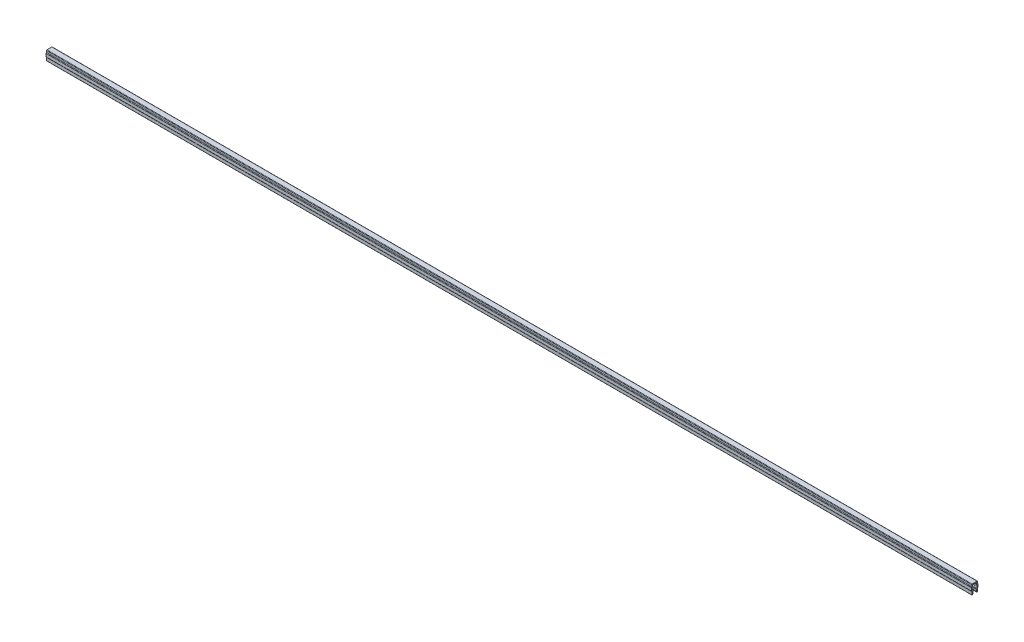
SolidWorks part; units mm, degrees
ref_plane "正面" through (0, 0, 0) normal (0, 0, 1) x (1, 0, 0)
ref_plane "平面" through (0, 0, 0) normal (0, 1, 0) x (1, 0, 0)
ref_plane "右側面" through (0, 0, 0) normal (1, 0, 0) x (0, 0, -1)
sketch "ｽｹｯﾁ1" plane through (0, 0, 0) normal (1, 0, 0) x (0, 0, -1)
  line L48 (-2.0164, -9.4834) -> (-2.5164, -10.3494)
  line L49 (-2.5164, -10.3494) -> (-2.7164, -10.3494)
  line L50 (-3.0164, -10.0494) -> (-3.0164, -7.0359)
  line L51 (-2.0164, -9.4834) -> (-2.0164, -7.4155)
  line L52 (-0.8966, -6.2427) -> (-1.8378, -7.0325)
  line L53 (-1.8164, -5.8895) -> (-1.0252, -5.8895)
  line L54 (-3.6164, -5.9966) -> (-3.6164, -3.0741)
  line L55 (-2.6164, -5.0895) -> (-2.6164, -3.6396)
  line L56 (-2.1164, -2.7736) -> (-2.1164, -1.5)
  line L57 (-3.1164, -2.0494) -> (-3.1164, -0.5)
  line L58 (3.1164, -2.2081) -> (3.1164, -0.5)
  line L59 (2.6164, -5.0895) -> (2.6164, -3.6396)
  line L60 (3.6164, -5.9966) -> (3.6164, -3.0741)
  line L61 (3.0164, -10.0494) -> (3.0164, -7.0359)
  line L62 (2.1164, -2.7736) -> (2.1164, -1.5)
  line L63 (1.8164, -5.8895) -> (1.0252, -5.8895)
  line L64 (0.8966, -6.2427) -> (1.8378, -7.0325)
  line L65 (1.6164, -1) -> (-1.6164, -1)
  line L66 (2.6164, 0) -> (-2.6164, 0)
  line L67 (2.0164, -9.4834) -> (2.5164, -10.3494)
  line L68 (2.0164, -9.4834) -> (2.0164, -7.4155)
  line L69 (2.5164, -10.3494) -> (2.7164, -10.3494)
  arc A50 (-3.0164, -10.0494) -> (-2.7164, -10.3494) centre (-2.7164, -10.0494) ccw
  arc A51 (-3.6164, -5.9966) -> (-3.3664, -6.4297) centre (-3.1164, -5.9966) ccw
  arc A52 (-3.0164, -7.0359) -> (-3.3664, -6.4297) centre (-3.7164, -7.0359) ccw
  arc A53 (-2.6164, -5.0895) -> (-1.8164, -5.8895) centre (-1.8164, -5.0895) ccw
  arc A54 (-3.4241, -2.68) -> (-3.6164, -3.0741) centre (-3.1164, -3.0741) ccw
  arc A55 (-3.4241, -2.68) -> (-3.1164, -2.0494) centre (-3.9164, -2.0494) ccw
  arc A56 (-2.3664, -3.2066) -> (-2.1164, -2.7736) centre (-2.6164, -2.7736) ccw
  arc A57 (-2.3664, -3.2066) -> (-2.6164, -3.6396) centre (-2.1164, -3.6396) ccw
  arc A58 (1.8164, -5.8895) -> (2.6164, -5.0895) centre (1.8164, -5.0895) ccw
  arc A59 (3.3664, -6.4297) -> (3.6164, -5.9966) centre (3.1164, -5.9966) ccw
  arc A60 (3.6164, -3.0741) -> (3.3664, -2.6411) centre (3.1164, -3.0741) ccw
  arc A61 (2.6164, -3.6396) -> (2.3664, -3.2066) centre (2.1164, -3.6396) ccw
  arc A62 (3.3664, -6.4297) -> (3.0164, -7.0359) centre (3.7164, -7.0359) ccw
  arc A63 (2.7164, -10.3494) -> (3.0164, -10.0494) centre (2.7164, -10.0494) ccw
  arc A64 (2.1164, -2.7736) -> (2.3664, -3.2066) centre (2.6164, -2.7736) ccw
  arc A65 (-0.8966, -6.2427) -> (-1.0252, -5.8895) centre (-1.0252, -6.0895) ccw
  arc A66 (-1.8378, -7.0325) -> (-2.0164, -7.4155) centre (-1.5164, -7.4155) ccw
  arc A67 (2.0164, -7.4155) -> (1.8378, -7.0325) centre (1.5164, -7.4155) ccw
  arc A68 (1.0252, -5.8895) -> (0.8966, -6.2427) centre (1.0252, -6.0895) ccw
  arc A69 (3.1164, -2.2081) -> (3.3664, -2.6411) centre (3.6164, -2.2081) ccw
  arc A70 (2.1164, -1.5) -> (1.6164, -1) centre (1.6164, -1.5) ccw
  arc A71 (3.1164, -0.5) -> (2.6164, 0) centre (2.6164, -0.5) ccw
  arc A72 (-1.6164, -1) -> (-2.1164, -1.5) centre (-1.6164, -1.5) ccw
  arc A73 (-2.6164, 0) -> (-3.1164, -0.5) centre (-2.6164, -0.5) ccw
extrude "押し出し1" add sketch "ｽｹｯﾁ1" along normal blind 1000
